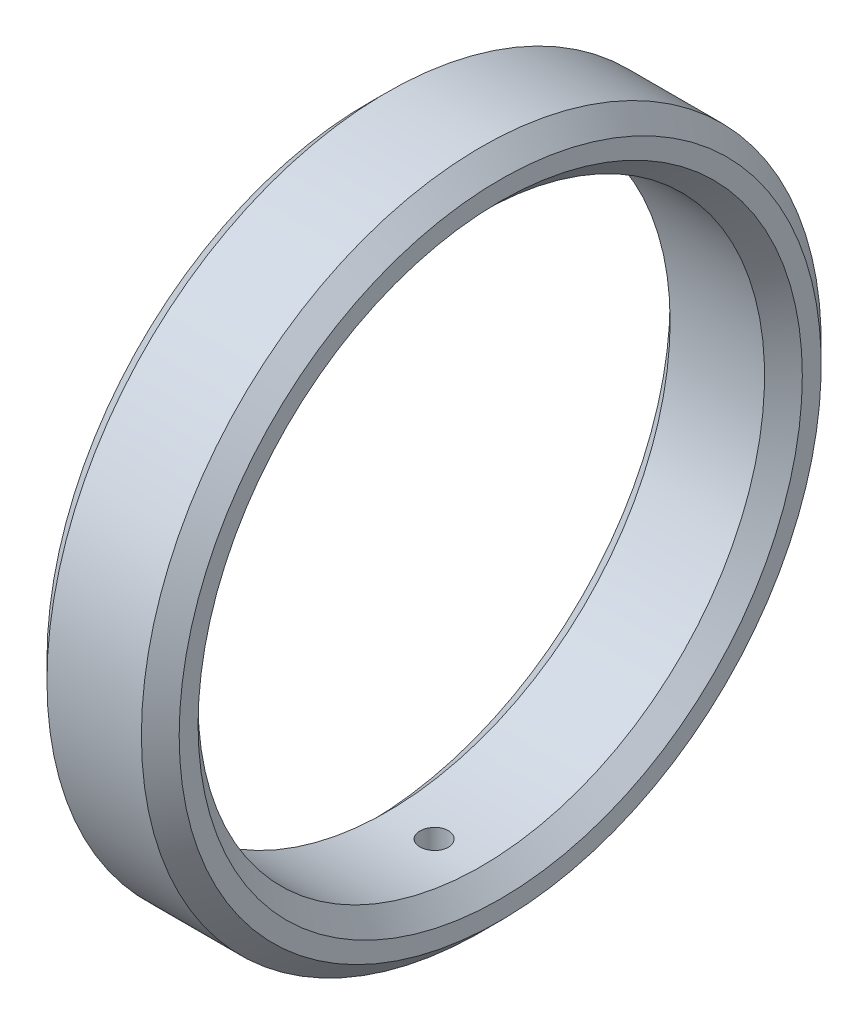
SolidWorks part; units mm, degrees
ref_plane "Face" through (0, 0, 0) normal (0, 0, 1) x (1, 0, 0)
ref_plane "Dessus" through (0, 0, 0) normal (0, 1, 0) x (1, 0, 0)
ref_plane "Droite" through (0, 0, 0) normal (1, 0, 0) x (0, 0, -1)
sketch "Esquisse1" plane through (0, 0, 0) normal (0, 0, 1) x (1, 0, 0)
  line L0 (-47.2046, 0) -> (35.9206, 0) construction
  line L1 (-18.9947, 17) -> (-18.9947, 0)
  line L2 (-11.9947, 17) -> (-11.9947, 0)
  line L3 (-18.9947, 0) -> (-11.9947, 0)
  line L4 (-17.9947, 18) -> (-12.9947, 18)
  line L5 (-18.9947, 17) -> (-17.9947, 18)
  line L6 (-12.9947, 18) -> (-11.9947, 17)
  point P3 (-18.9947, 18)
  point P5 (-11.9947, 18)
  dimension "D1" = 18
  dimension "D2" = 7
revolve "Base-Révolution" add sketch "Esquisse1" angle 360 about L0
sketch "Esquisse2" plane through (-18.9947, 0, 0) normal (-1, 0, 0) x (0, 0, 1)
  circle A0 centre (0, 0) radius 15
extrude "Enlèv. mat.-Extru.1" cut sketch "Esquisse2" against normal through all
chamfer "Chanfrein1" distance 1 angle 45
sketch "Esquisse3" plane through (0, 0, 0) normal (0, 1, 0) x (1, 0, 0)
  line L2 (-12.9947, 0) -> (-17.9947, 0) construction
  line L3 (-11.9947, -17) -> (-11.9947, 17) construction
  circle A0 centre (-15.4947, 0) radius 0.75
  dimension "D1" = 3.5
extrude "Enlèv. mat.-Extru.2" cut sketch "Esquisse3" against normal blind 20
